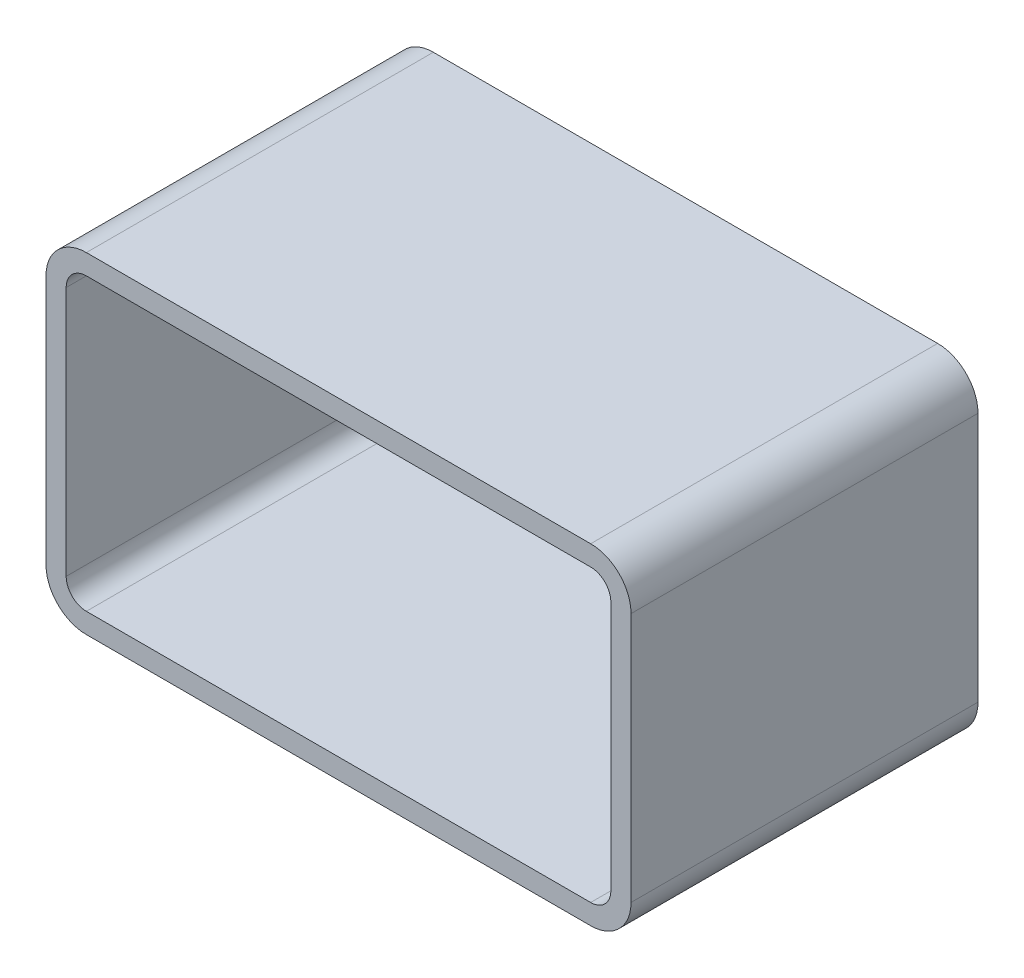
SolidWorks part; units mm, degrees
ref_plane "Plane1" through (0, 0, 0) normal (0, 0, 1) x (1, 0, 0)
ref_plane "Plane2" through (0, 0, 0) normal (0, 1, 0) x (1, 0, 0)
ref_plane "Plane3" through (0, 0, 0) normal (1, 0, 0) x (0, 0, -1)
sketch "Sketch1" plane through (0, 0, 0) normal (0, 0, 1) x (1, 0, 0)
  line L1 (0, 0) -> (290, 0)
  line L2 (0, 0) -> (0, 164)
  line L3 (0, 164) -> (290, 164)
  line L4 (290, 0) -> (290, 164)
  dimension "box_width" = 290
  dimension "box_height" = 164
extrude "Box" add sketch "Sketch1" against normal blind 172
fillet "OutsideCorners" radius 20 4 edges at (0, 164, -86) (290, 164, -86) (290, 0, -86) (0, 0, -86)
shell "Shell1" thickness 10
